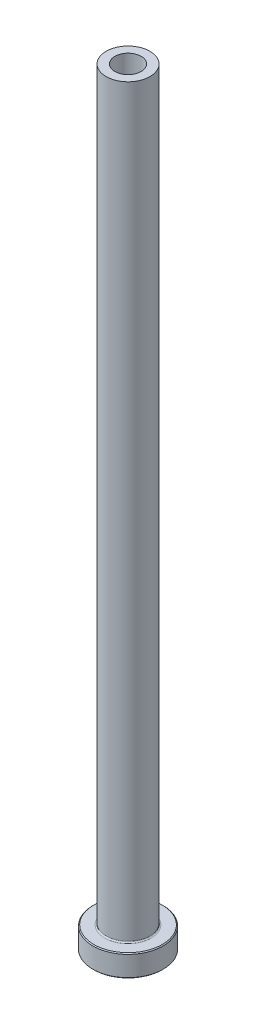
SolidWorks part; units mm, degrees
ref_plane "Front Plane" through (0, 0, 0) normal (0, 0, 1) x (1, 0, 0)
ref_plane "Top Plane" through (0, 0, 0) normal (0, 1, 0) x (1, 0, 0)
ref_plane "Right Plane" through (0, 0, 0) normal (1, 0, 0) x (0, 0, -1)
sketch "Sketch1" plane through (0, 0, 0) normal (0, 0, 1) x (1, 0, 0)
  line L0 (-3, 175) -> (-5, 175)
  line L1 (-5, 175) -> (-5, 5)
  line L2 (-5, 5) -> (-8, 5)
  line L3 (-8, 5) -> (-8, 0)
  line L4 (8.8, 0) -> (-8.8, 0) construction
  line L5 (-8, 0) -> (-3.25, 0)
  line L6 (-3, 130) -> (-3, 175)
  line L7 (0, 92.1877) -> (0, -15.5353) construction
  line L8 (0, -8.8) -> (0, 8.8) construction
  line L9 (-3, 130) -> (-3.25, 118)
  line L10 (-3.25, 118) -> (-3.25, 0)
  dimension "D1" = 0.25
  dimension "ID" = 6
  dimension "OD" = 10
  dimension "L" = 175
  dimension "H" = 16
  dimension "T" = 5
  dimension "N" = 45
  dimension "D2" = 12
revolve "Revolve1" add sketch "Sketch1" angle 360 about L7
fillet "Fillet1" radius 0.3 1 edges at (0, 5, 5)
chamfer "Chamfer1" distance 0.2 angle 45 2 edges at (0, 5, 8) (0, 0, 8)
chamfer "Chamfer3" distance 0.5 angle 45 1 edges at (0, 0, 3.25)
